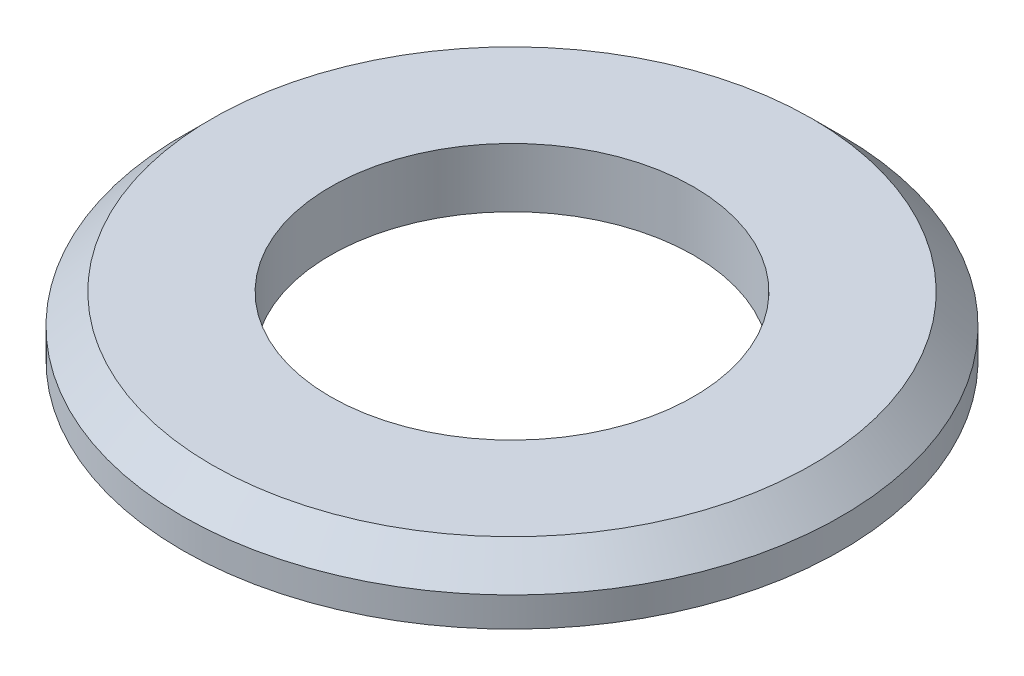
SolidWorks part; units mm, degrees
ref_plane "Front" through (0, 0, 0) normal (0, 0, 1) x (1, 0, 0)
ref_plane "Top" through (0, 0, 0) normal (0, 1, 0) x (1, 0, 0)
ref_plane "Right" through (0, 0, 0) normal (1, 0, 0) x (0, 0, -1)
sketch "Sketch1" plane through (0, 0, 0) normal (0, 1, 0) x (1, 0, 0)
  circle A0 centre (0, 0) radius 21.5
  circle A1 centre (0, 0) radius 39
extrude "Extrude1" add sketch "Sketch1" along normal blind 7
chamfer "Chamfer1" distance 3.5 1 edges at (0, 7, 39)
